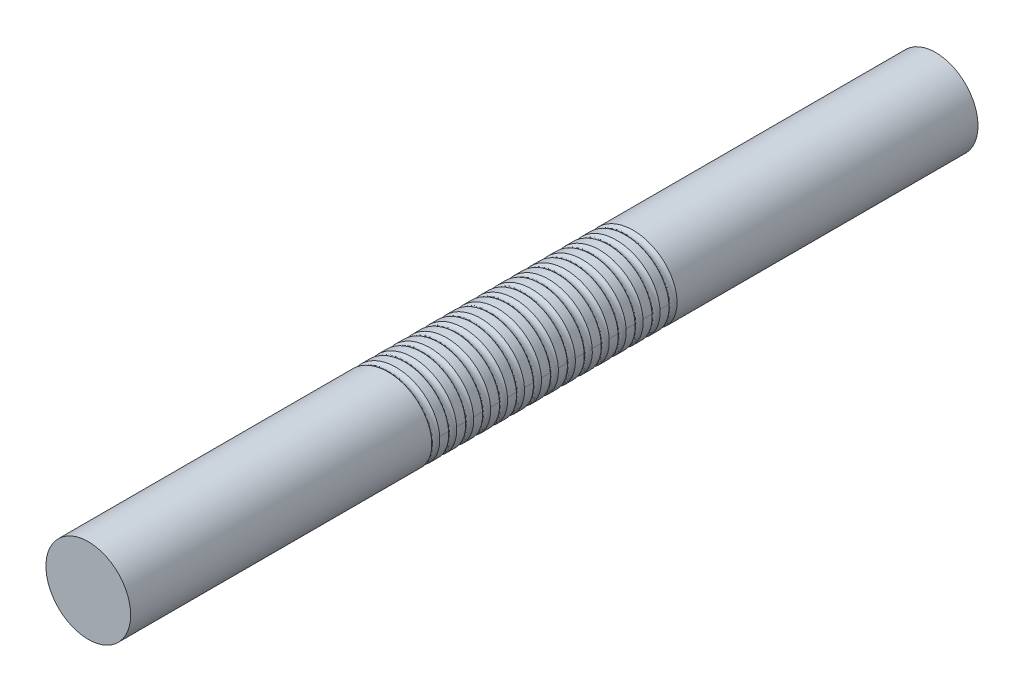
SolidWorks part; units mm, degrees
ref_plane "Front Plane" through (0, 0, 0) normal (0, 0, 1) x (1, 0, 0)
ref_plane "Top Plane" through (0, 0, 0) normal (0, 1, 0) x (1, 0, 0)
ref_plane "Right Plane" through (0, 0, 0) normal (1, 0, 0) x (0, 0, -1)
sketch "Sketch1" plane through (0, 0, 0) normal (0, 0, 1) x (1, 0, 0)
  circle A0 centre (0, 0) radius 25
  dimension "D1" = 50
extrude "Boss-Extrude1" add sketch "Sketch1" along normal blind 500
ref_plane "Plane1" through (0, 0, 175) normal (0, 0, 1) x (1, 0, 0)
sketch "Sketch2" plane through (0, 0, 175) normal (0, 0, 1) x (1, 0, 0)
  circle A0 centre (0, 0) radius 27.1167
  dimension "D1" = 54.2333
curve "Helix/Spiral1"
sketch "Sketch3" plane through (0, 0, 0) normal (0, 1, 0) x (1, 0, 0)
  circle A0 centre (-27.1167, -175) radius 3.175
  spline S0 degree 3 number of poles 349 (-27.1167, -175) -> (-27.1167, -325) construction
  dimension "D1" = 6.35
sweep "Cut-Sweep1" cut profiles "Sketch3" path "Helix/Spiral1"
pattern_linear "LPattern1" [suppressed] count 2 spacing 500
